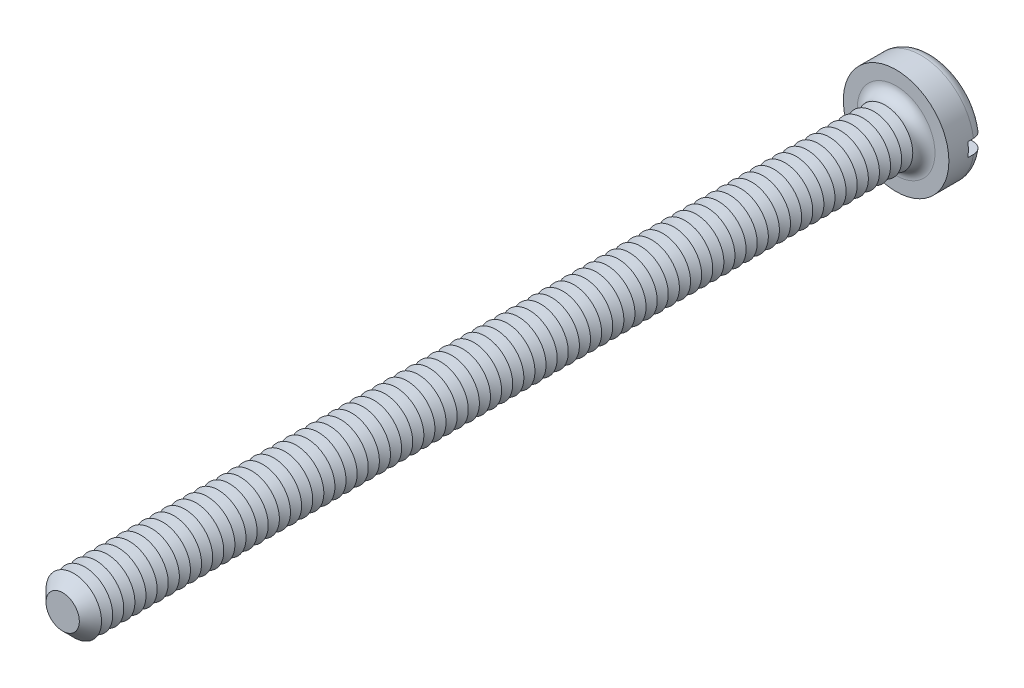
SolidWorks part; units mm, degrees
ref_plane "Front Plane" through (0, 0, 0) normal (0, 0, 1) x (1, 0, 0)
ref_plane "Top Plane" through (0, 0, 0) normal (0, 1, 0) x (1, 0, 0)
ref_plane "Right Plane" through (0, 0, 0) normal (1, 0, 0) x (0, 0, -1)
sketch "Sketch3" plane through (0, 0, 0) normal (0, 0, 1) x (1, 0, 0)
  circle A0 centre (0, 0) radius 1.9
  dimension "D1" = 3.8
extrude "Boss-Extrude2" add sketch "Sketch3" against normal blind 1.3
sketch "Sketch4" plane through (0, 0, 0) normal (0, 0, 1) x (1, 0, 0)
  circle A0 centre (0, 0) radius 1
  dimension "D1" = 2
extrude "Boss-Extrude3" add sketch "Sketch4" along normal blind 30
fillet "Fillet1" radius 0.4 2 edges at (1.9, 0, -1.3) (1, 0, 0)
chamfer "Chamfer1" distance 0.4 angle 45 1 edges at (1, 0, 30)
sketch "Sketch5" plane through (0, 0, 0) normal (1, 0, 0) x (0, 0, -1)
  line L0 (1.6944, 0) -> (-7.6738, 0) construction
sketch "Sketch6" plane through (0, 0, 0) normal (1, 0, 0) x (0, 0, -1)
  line L0 (-0.4, 1) -> (-0.6, 0.6536)
  line L1 (-0.6, 0.6536) -> (-0.8, 1)
  line L2 (-0.4, 1) -> (-29.6, 1) construction
  line L3 (-0.8, 1) -> (-0.4, 1)
  dimension "D1" = 0.4
revolve "Cut-Revolve1" cut sketch "Sketch6" angle 360 about L0
pattern_linear "LPattern1" count 73 spacing 0.4 along (0, 0, 1) of "Cut-Revolve1"
sketch "Sketch8" plane through (0, 0, -1.3) normal (0, 0, -1) x (-1, 0, 0)
  line L1 (1.9, -0.25) -> (-1.9, -0.25)
  line L2 (1.9, -0.25) -> (1.9, 0.25)
  line L3 (1.9, 0.25) -> (-1.9, 0.25)
  line L4 (-1.9, -0.25) -> (-1.9, 0.25)
  line L5 (1.9, -0.25) -> (-1.9, 0.25) construction
  line L6 (1.9, 0.25) -> (-1.9, -0.25) construction
  point P0 (0, 0)
  dimension "D1" = 3.8
  dimension "D2" = 0.5
extrude "Cut-Extrude1" cut sketch "Sketch8" against normal blind 0.6
